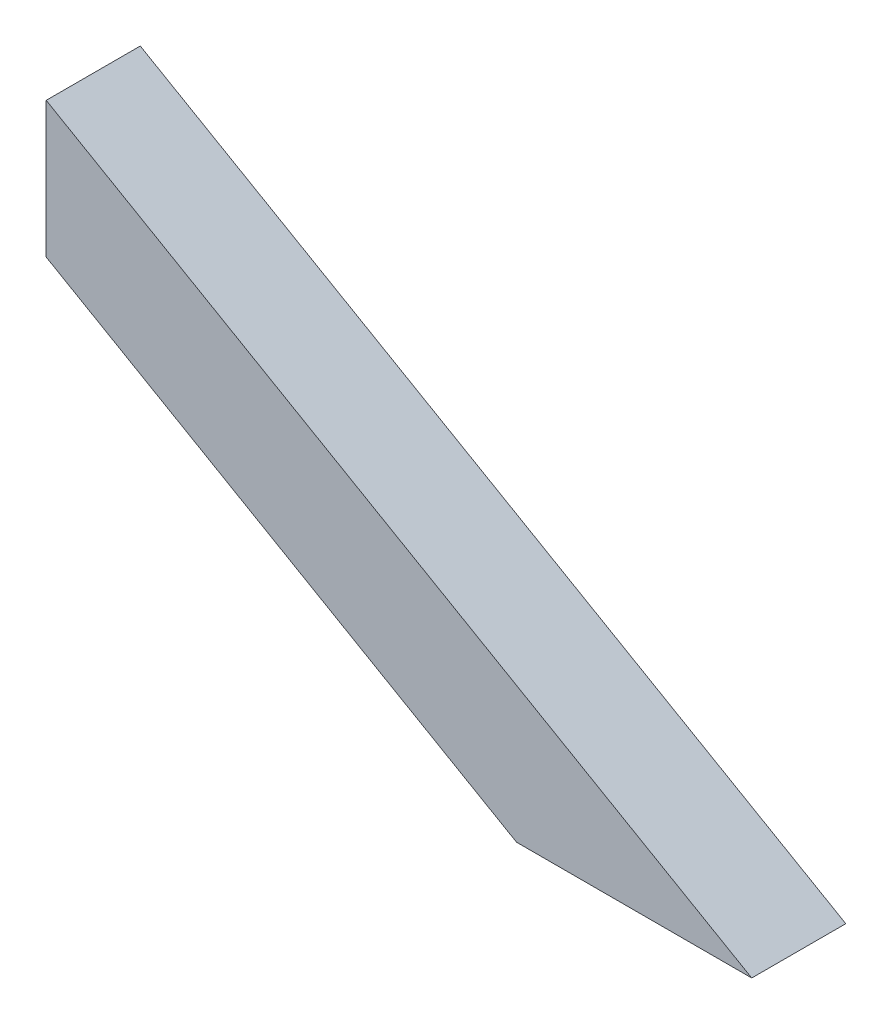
SolidWorks part; units mm, degrees
ref_plane "Ebene vorne" through (0, 0, 0) normal (0, 0, 1) x (1, 0, 0)
ref_plane "Ebene oben" through (0, 0, 0) normal (0, 1, 0) x (1, 0, 0)
ref_plane "Ebene rechts" through (0, 0, 0) normal (1, 0, 0) x (0, 0, -1)
sketch "Skizze1" plane through (0, 0, 0) normal (0, 0, 1) x (1, 0, 0)
  line L0 (0, 57.735) -> (0, 86.6025)
  line L1 (0, 86.6025) -> (150, 0)
  line L2 (150, 0) -> (100, 0)
  line L3 (100, 0) -> (0, 57.735)
  dimension "D1" = 25
  dimension "D2" = 150
  dimension "D3" = 150
extrude "Linear austragen1" add sketch "Skizze1" along normal blind 20
sketch "Skizze2" plane through (0, 0, 0) normal (0, -1, 0) x (1, 0, 0)
  line L0 (150, 10) -> (100, 10) construction
  line L1 (150, 20) -> (150, 0) construction
  line L2 (100, 20) -> (100, 0) construction
